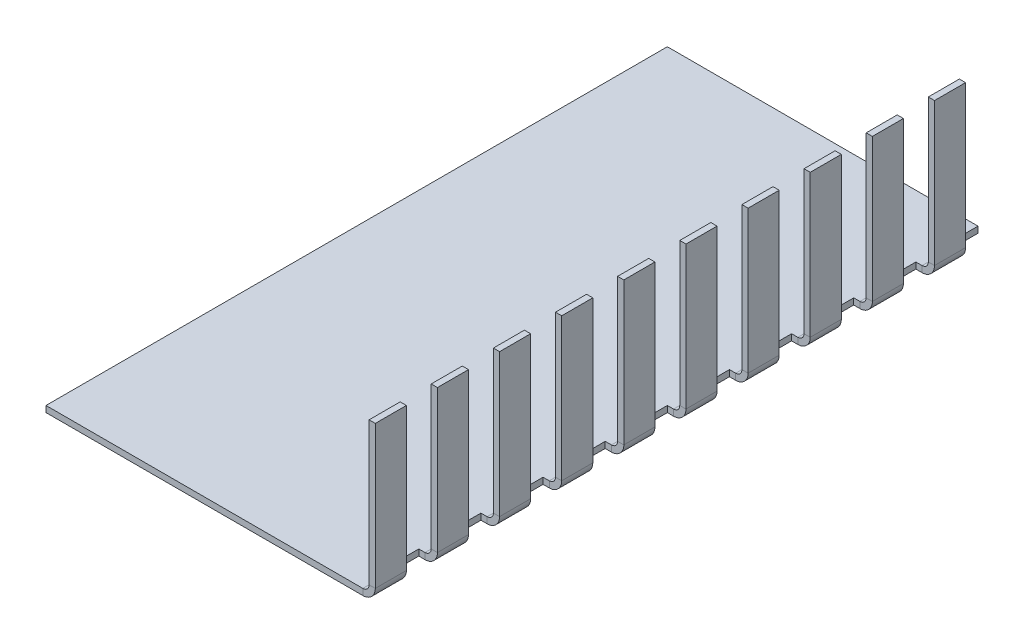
SolidWorks part; units mm, degrees
ref_plane "Vorne" through (0, 0, 0) normal (0, 0, 1) x (1, 0, 0)
ref_plane "Oben" through (0, 0, 0) normal (0, 1, 0) x (1, 0, 0)
ref_plane "Rechts" through (0, 0, 0) normal (1, 0, 0) x (0, 0, -1)
sketch "Skizze1" plane through (0, 0, 0) normal (0, 0, 1) x (1, 0, 0)
  line L0 (0, 0) -> (100, 0)
  dimension "D1" = 100
extrude "Linear-Austragen-Dünn1" add sketch "Skizze1" along normal blind 200 thin
sketch "Skizze2" plane through (0, 0, 200) normal (0, 0, 1) x (1, 0, 0)
  line L0 (100, -2) -> (106, -2)
  line L1 (106, -2) -> (106, 48)
  dimension "D1" = 6
  dimension "D2" = 50
extrude "Linear-Austragen-Dünn2" add sketch "Skizze2" against normal blind 10 thin
pattern_linear "Lineares Muster2" count 10 spacing 20 along (0, 0, -1) of "Linear-Austragen-Dünn2"
sheet metal parameters "Blech1" parameters "D1"=2
bend "Biegung-Winkel10" bend angle 90 parameters "D1"=0, "D5"=1
flatten bends "Abwickeln1" parameters "D1"=0
sketch "Skizze-Winkel1" plane through (0, 0, 0) normal (0, 1, 0) x (-1, 0, 0)
  line L0 (-104.3562, 200) -> (-104.3562, 190) construction
  line L1 (-104.3562, 180) -> (-104.3562, 170) construction
  line L2 (-104.3562, 160) -> (-104.3562, 150) construction
  line L3 (-104.3562, 140) -> (-104.3562, 130) construction
  line L4 (-104.3562, 120) -> (-104.3562, 110) construction
  line L5 (-104.3562, 100) -> (-104.3562, 90) construction
  line L6 (-104.3562, 80) -> (-104.3562, 70) construction
  line L7 (-104.3562, 60) -> (-104.3562, 50) construction
  line L8 (-104.3562, 40) -> (-104.3562, 30) construction
  line L9 (-104.3562, 20) -> (-104.3562, 10) construction
bend "Biegung-Winkel1" bend angle 90 parameters "D1"=0, "D5"=10
bend "Biegung-Winkel2" bend angle 90 parameters "D1"=0, "D5"=9
bend "Biegung-Winkel3" bend angle 90 parameters "D1"=0, "D5"=8
bend "Biegung-Winkel4" bend angle 90 parameters "D1"=0, "D5"=7
bend "Biegung-Winkel5" bend angle 90 parameters "D1"=0, "D5"=6
bend "Biegung-Winkel6" bend angle 90 parameters "D1"=0, "D5"=5
bend "Biegung-Winkel7" bend angle 90 parameters "D1"=0, "D5"=4
bend "Biegung-Winkel8" bend angle 90 parameters "D1"=0, "D5"=3
bend "Biegung-Winkel9" bend angle 90 parameters "D1"=0, "D5"=2
process bends "Abbiegen1" parameters "D1"=0
sketch "Abwicklung-Skizze1" plane through (0, 0, 0) normal (0, 1, 0) x (-1, 0, 0)
flat pattern "Abwicklung1"
sketch "Biegung-Linien1" plane through (0, 0, 0) normal (0, 1, 0) x (-1, 0, 0)
  line L0 (-104.3562, 10) -> (-104.3562, 20) construction
  line L1 (-104.3562, 30) -> (-104.3562, 40) construction
  line L2 (-104.3562, 50) -> (-104.3562, 60) construction
  line L3 (-104.3562, 70) -> (-104.3562, 80) construction
  line L4 (-104.3562, 90) -> (-104.3562, 100) construction
  line L5 (-104.3562, 110) -> (-104.3562, 120) construction
  line L6 (-104.3562, 130) -> (-104.3562, 140) construction
  line L7 (-104.3562, 150) -> (-104.3562, 160) construction
  line L8 (-104.3562, 170) -> (-104.3562, 180) construction
  line L9 (-104.3562, 190) -> (-104.3562, 200) construction
  line L10 (-104.3562, 10) -> (-104.3562, 20) construction
  line L11 (-104.3562, 30) -> (-104.3562, 40) construction
  line L12 (-104.3562, 50) -> (-104.3562, 60) construction
  line L13 (-104.3562, 70) -> (-104.3562, 80) construction
  line L14 (-104.3562, 90) -> (-104.3562, 100) construction
  line L15 (-104.3562, 110) -> (-104.3562, 120) construction
  line L16 (-104.3562, 130) -> (-104.3562, 140) construction
  line L17 (-104.3562, 150) -> (-104.3562, 160) construction
  line L18 (-104.3562, 170) -> (-104.3562, 180) construction
  line L19 (-104.3562, 190) -> (-104.3562, 200) construction
bend of the flat pattern "Abwickeln-<Biegung-Winkel1>1"
bend of the flat pattern "Abwickeln-<Biegung-Winkel2>1"
bend of the flat pattern "Abwickeln-<Biegung-Winkel3>1"
bend of the flat pattern "Abwickeln-<Biegung-Winkel4>1"
bend of the flat pattern "Abwickeln-<Biegung-Winkel5>1"
bend of the flat pattern "Abwickeln-<Biegung-Winkel6>1"
bend of the flat pattern "Abwickeln-<Biegung-Winkel7>1"
bend of the flat pattern "Abwickeln-<Biegung-Winkel8>1"
bend of the flat pattern "Abwickeln-<Biegung-Winkel9>1"
bend of the flat pattern "Abwickeln-<Biegung-Winkel10>1"
